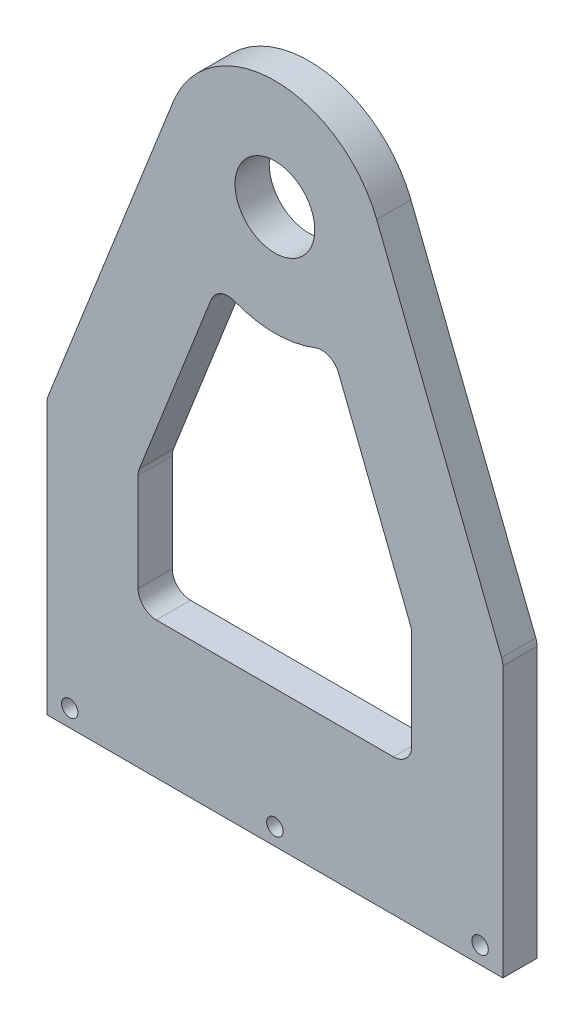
SolidWorks part; units mm, degrees
ref_plane "Front Plane" through (0, 0, 0) normal (0, 0, 1) x (1, 0, 0)
ref_plane "Top Plane" through (0, 0, 0) normal (0, 1, 0) x (1, 0, 0)
ref_plane "Right Plane" through (0, 0, 0) normal (1, 0, 0) x (0, 0, -1)
sketch "Sketch1" plane through (0, 0, 0) normal (0, 0, 1) x (1, 0, 0)
  line L0 (-31.75, 0) -> (31.75, 0)
  line L1 (31.75, 0) -> (31.75, 38.1)
  line L2 (31.75, 38.1) -> (14.1794, 82.7027)
  line L3 (0, 0) -> (0, 126.9546) construction
  line L4 (-31.75, 0) -> (-31.75, 38.1)
  line L5 (-31.75, 38.1) -> (-14.1794, 82.7027)
  arc A0 (-14.1794, 82.7027) -> (14.1794, 82.7027) centre (0, 77.1169) cw
  circle A1 centre (0, 77.1169) radius 5.5562
  dimension "D3" = 77.1169
  dimension "D4" = 15.24
  dimension "D5" = 11.1125
  dimension "D1" = 63.5
  dimension "D2" = 38.1
extrude "Boss-Extrude1" add sketch "Sketch1" along normal blind 4.7625
sketch "Sketch2" plane through (0, 0, 4.7625) normal (0, 0, 1) x (1, 0, 0)
  line L0 (0, 92.3569) -> (0, 0) construction
  line L1 (-31.75, 0) -> (31.75, 0) construction
  line L2 (-31.75, 38.1) -> (-31.75, 0) construction
  circle A0 centre (-28.575, 2.3813) radius 1.143
  arc A1 (14.1794, 82.7027) -> (-14.1794, 82.7027) centre (0, 77.1169) ccw construction
  circle A2 centre (28.575, 2.3813) radius 1.143
  circle A3 centre (0, 2.3813) radius 1.143
  dimension "D3" = 2.286
  dimension "D1" = 2.3813
  dimension "D2" = 3.175
extrude "Cut-Extrude1" cut sketch "Sketch2" against normal through all
sketch "Sketch3" plane through (0, 0, 4.7625) normal (0, 0, 1) x (1, 0, 0)
  line L0 (-19.05, 35.6887) -> (-19.05, 19.05)
  line L1 (-19.05, 19.05) -> (19.05, 19.05)
  line L2 (19.05, 19.05) -> (19.05, 35.6887)
  line L3 (19.05, 35.6887) -> (7.8709, 64.0668)
  line L4 (-7.8709, 64.0668) -> (-19.05, 35.6887)
  line L5 (-31.75, 38.1) -> (-31.75, 0)
  line L6 (-31.75, 0) -> (31.75, 0)
  line L7 (31.75, 0) -> (31.75, 38.1)
  line L8 (31.75, 38.1) -> (14.1794, 82.7027)
  line L9 (-14.1794, 82.7027) -> (-31.75, 38.1)
  line L10 (-31.75, 38.1) -> (-31.75, 0) construction
  line L11 (-31.75, 0) -> (31.75, 0) construction
  line L12 (31.75, 0) -> (31.75, 38.1) construction
  line L13 (31.75, 38.1) -> (14.1794, 82.7027) construction
  line L14 (-14.1794, 82.7027) -> (-31.75, 38.1) construction
  line L15 (-2.3632, 78.0479) -> (-19.05, 35.6887) construction
  line L16 (19.05, 35.6887) -> (2.3632, 78.0479) construction
  line L17 (-19.05, 35.6887) -> (-19.05, 12.7) construction
  line L18 (19.05, 12.7) -> (19.05, 35.6887) construction
  line L22 (-19.05, 12.7) -> (19.05, 12.7) construction
  arc A0 (-7.8709, 64.0668) -> (7.8709, 64.0668) centre (0, 77.1169) ccw
  arc A1 (14.1794, 82.7027) -> (-14.1794, 82.7027) centre (0, 77.1169) ccw
  arc A2 (14.1794, 82.7027) -> (-14.1794, 82.7027) centre (0, 77.1169) ccw construction
  arc A3 (2.3632, 78.0479) -> (-2.3632, 78.0479) centre (0, 77.1169) ccw construction
  dimension "D3" = 19.05
  dimension "D1" = 0
  dimension "D2" = 12.7
extrude "Cut-Extrude2" cut sketch "Sketch3" against normal through all
fillet "Fillet3" radius 2.54 8 edges at (31.75, 38.1, 2.3813) (-31.75, 38.1, 2.3813) (7.8709, 64.0668, 2.3813) (-7.8709, 64.0668, 2.3813) (19.05, 35.6887, 2.3813) (19.05, 19.05, 2.3813) (-19.05, 19.05, 2.3813) (-19.05, 35.6887, 2.3813)
